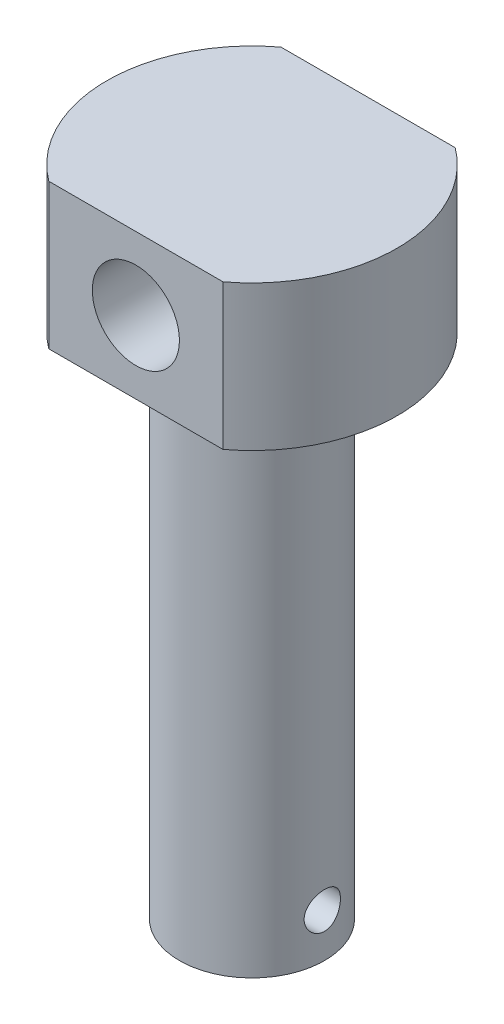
SolidWorks part; units mm, degrees
ref_plane "Frontal" through (0, 0, 0) normal (0, 0, 1) x (1, 0, 0)
ref_plane "Horizontal" through (0, 0, 0) normal (0, 1, 0) x (1, 0, 0)
ref_plane "Vertical" through (0, 0, 0) normal (1, 0, 0) x (0, 0, -1)
sketch "Esquisse1" plane through (0, 0, 0) normal (0, 0, 1) x (1, 0, 0)
  line L0 (0, 103.5512) -> (0, -28.104) construction
  line L1 (0, 0) -> (5, 0)
  line L2 (5, 0) -> (5, 35)
  line L3 (5, 35) -> (10, 35)
  line L4 (10, 35) -> (10, 45)
  line L5 (10, 45) -> (0, 45)
  line L6 (0, 45) -> (0, 0)
  dimension "D1" = 10
  dimension "D2" = 20
  dimension "D3" = 35
  dimension "D4" = 45
revolve "Révolution1" add sketch "Esquisse1" angle 360 about L0
sketch "Esquisse2" plane through (0, 45, 0) normal (0, 1, 0) x (1, 0, 0)
  line L0 (-16.3384, 0) -> (14.749, 0) construction
  line L1 (-6, 8) -> (6, 8)
  line L2 (-6, 8) -> (-6, 14.6725)
  line L3 (-6, 14.6725) -> (6, 14.6725)
  line L4 (6, 8) -> (6, 14.6725)
  line L5 (6, -8) -> (6, -14.6725)
  line L6 (-6, -14.6725) -> (6, -14.6725)
  line L7 (-6, -8) -> (-6, -14.6725)
  line L8 (-6, -8) -> (6, -8)
  circle A0 centre (0, 0) radius 10 construction
  dimension "D1" = 16
extrude "Extrusion1" cut sketch "Esquisse2" against normal through all
hole_wizard "Diamètre du perçage Ø6.0 (6)1" positions "Esquisse4" profile "Esquisse3" hole size "Ø6.0" standard "ISO"
sketch "Esquisse4" plane through (0, 0, 8) normal (0, 0, 1) x (1, 0, 0)
  line L0 (0, -2.1802) -> (0, 47.617) construction
  line L1 (-5, 0) -> (5, 0) construction
  point P0 (0, 40)
  dimension "D1" = 40
sketch "Esquisse3" plane through (0, 40, 8) normal (1, 0, 0) x (0, -1, 0)
  line L0 (0, 0) -> (0, 16)
  line L1 (0, 16) -> (3, 16)
  line L2 (3, 16) -> (3, 0)
  line L5 (3, 0) -> (0, 0)
  line L11 (0, -6.35) -> (0, 107.95) construction
  dimension "Diamètre du perçage jusqu'au prochain" = 6
  dimension "Profondeur du perçage jusqu'au prochain" = 16
hole_wizard "Diamètre du perçage Ø3.0 (3)1" positions "Esquisse6" profile "Esquisse5" hole size "Ø3.0" standard "ISO"
sketch "Esquisse6" plane through (0, 0, 0) normal (0, -1, 0) x (1, 0, 0)
  point P0 (0, 0)
sketch "Esquisse5" plane through (0, 0, 0) normal (1, 0, 0) x (0, 0, -1)
  line L0 (0, 0) -> (0, 10.9013)
  line L1 (0, 10.9013) -> (1.5, 10)
  line L2 (1.5, 10) -> (1.5, 0)
  line L5 (1.5, 0) -> (0, 0)
  line L10 (0, 10.9013) -> (-1.5, 10) construction
  line L11 (0, -6.35) -> (0, 107.95) construction
  dimension "Diamètre du perçage" = 3
  dimension "Profondeur du perçage" = 10
  dimension "Angle de pointe" = 118
hole_wizard "Trou taraudé M31" positions "Esquisse8" profile "Esquisse7" tap size "M3" standard "ISO"
sketch "Esquisse8" plane through (0, 0, 0) normal (1, 0, 0) x (0, 0, -1)
  line L0 (0, -4.2989) -> (0, 46.9714) construction
  line L1 (-5, 0) -> (5, 0) construction
  point P0 (0, 3)
  dimension "D1" = 3
sketch "Esquisse7" plane through (0, 3, 0) normal (0, 1, 0) x (0, 0, 1)
  line L0 (0, 0) -> (0, 10)
  line L1 (0, 10) -> (1.25, 10)
  line L2 (1.25, 10) -> (1.25, 0)
  line L5 (1.25, 0) -> (0, 0)
  line L11 (0, -6.35) -> (0, 107.95) construction
  dimension "Diamètre du trou pour taraudage jusqu'au prochain" = 2.5
  dimension "Profondeur du trou pour taraudage jusqu'au prochain" = 10
